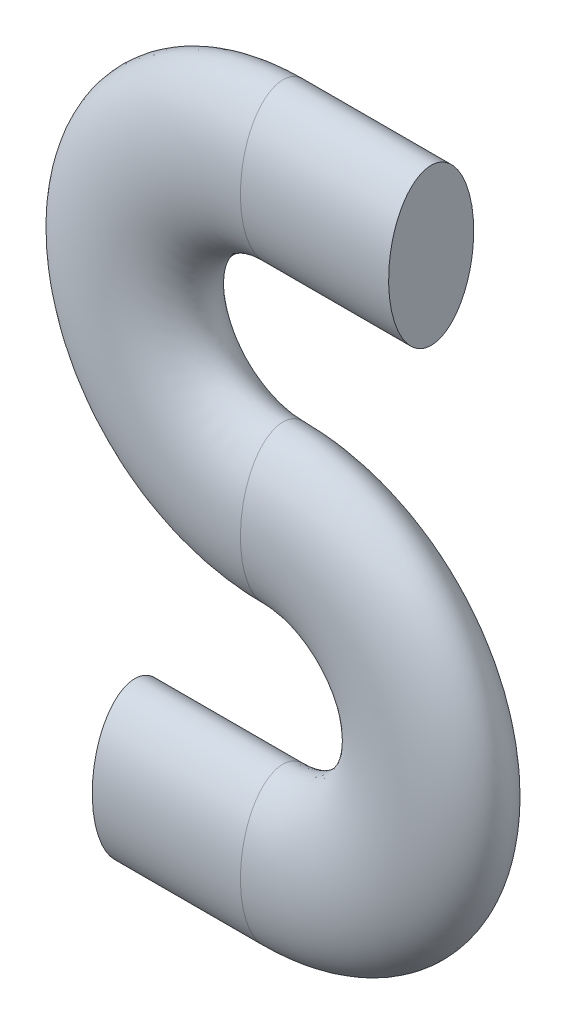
SolidWorks part; units mm, degrees
ref_plane "Plane1" through (0, 0, 0) normal (0, 0, 1) x (1, 0, 0)
ref_plane "Plane2" through (0, 0, 0) normal (0, 1, 0) x (1, 0, 0)
ref_plane "Plane3" through (0, 0, 0) normal (1, 0, 0) x (0, 0, -1)
sketch "Sketch1" plane through (0, 0, 0) normal (0, 0, 1) x (1, 0, 0)
  line L0 (0, 0) -> (13.9289, 0)
  line L1 (13.9289, 55.7155) -> (27.8578, 55.7155)
  line L2 (0, 0) -> (0, 78.9673) construction
  arc A0 (13.9289, 0) -> (13.9289, 27.8578) centre (13.9289, 13.9289) ccw
  arc A1 (13.9289, 27.8578) -> (13.9289, 55.7155) centre (13.9289, 41.7866) cw
sketch "Sketch2" plane through (0, 0, 0) normal (1, 0, 0) x (0, 0, -1)
  line L0 (0, 0) -> (0, 78.9673) construction
  ellipse E0 centre (0, 0) end of major axis (0, 7.3306) minor radius 4
sweep "Base-Sweep" add profiles "Sketch1" path "Sketch2"
